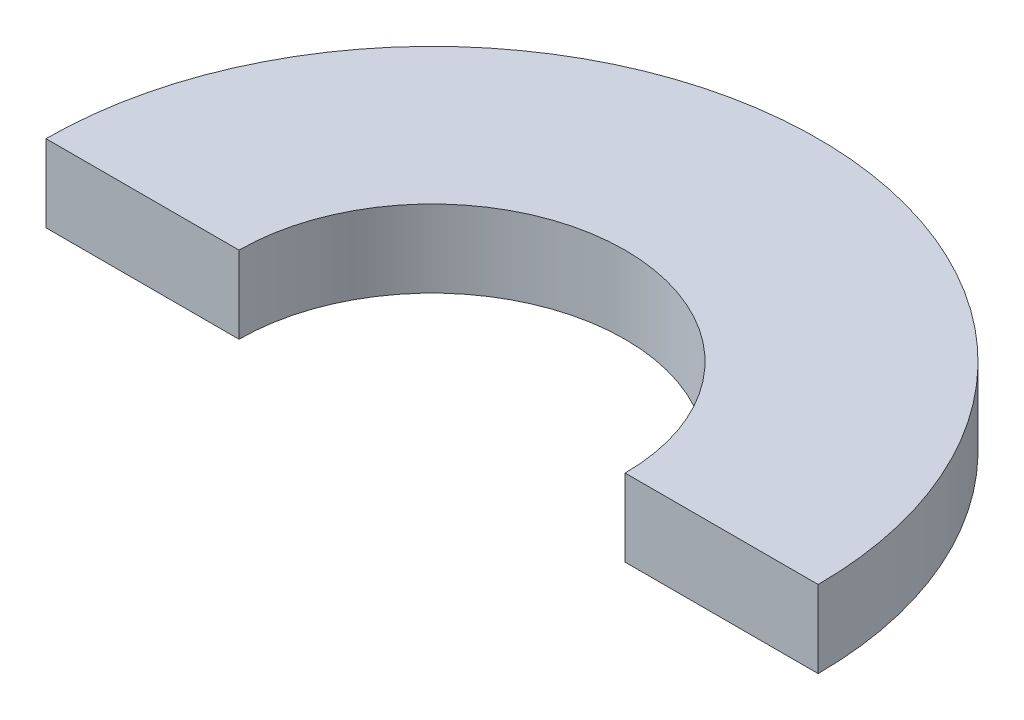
SolidWorks part; units mm, degrees
ref_plane "Face" through (0, 0, 0) normal (0, 0, 1) x (1, 0, 0)
ref_plane "Dessus" through (0, 0, 0) normal (0, 1, 0) x (1, 0, 0)
ref_plane "Droite" through (0, 0, 0) normal (1, 0, 0) x (0, 0, -1)
sketch "Esquisse1" plane through (0, 0, 0) normal (0, 1, 0) x (1, 0, 0)
  circle A0 centre (0, 0) radius 6
  circle A1 centre (0, 0) radius 3
  dimension "D1" = 12
  dimension "D2" = 6
extrude "Extrusion1" add sketch "Esquisse1" along normal blind 1.2
sketch "Esquisse2" plane through (0, 0, 0) normal (0, 0, 1) x (1, 0, 0)
  line L0 (0, 4.6708) -> (0, 1.2) construction
  line L1 (0, 0) -> (6, 0)
  line L2 (0, 0) -> (0, 1.2)
  line L3 (0, 1.2) -> (6, 1.2)
  line L4 (6, 0) -> (6, 1.2)
  line L6 (-6, 0) -> (6, 0) construction
  line L7 (6, 1.2) -> (-6, 1.2) construction
revolve "Coupe" cut sketch "Esquisse2" angle 180 about L0
